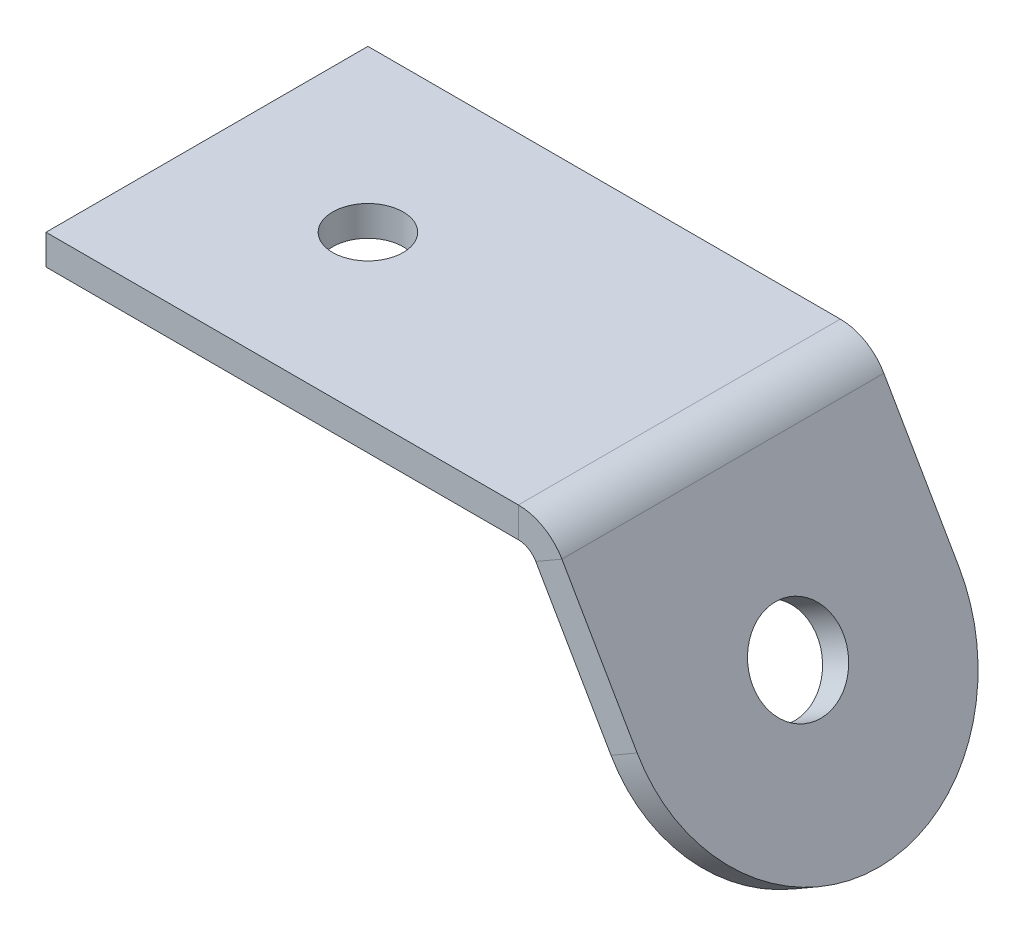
SolidWorks part; units mm, degrees
ref_plane "Front Plane" through (0, 0, 0) normal (0, 0, 1) x (1, 0, 0)
ref_plane "Top Plane" through (0, 0, 0) normal (0, 1, 0) x (1, 0, 0)
ref_plane "Right Plane" through (0, 0, 0) normal (1, 0, 0) x (0, 0, -1)
sketch "Sketch1" plane through (0, 0, 0) normal (0, 1, 0) x (1, 0, 0)
  line L0 (0, 8) -> (32, 8) construction
  line L1 (0, 0) -> (32, 0)
  line L2 (0, 0) -> (0, 16)
  line L3 (0, 16) -> (32, 16)
  arc A0 (32, 0) -> (32, 16) centre (32, 8) ccw
  circle A1 centre (32, 8) radius 2.25
  circle A2 centre (8, 8) radius 1.75
  dimension "D1" = 3.5
  dimension "D2" = 4.5
  dimension "D3" = 8
  dimension "D4" = 32
  dimension "D5" = 8
sheet metal parameters "Sheet-Metal1" thickness 1.5 parameters "D1"=1
base flange "Base-Flange1" sketch "Sketch1" thickness 1.5 reverse thickness direction yes parameters "D1"=1
sketch "Sketch3" plane through (0, 1.5, 0) normal (0, 1, 0) x (1, 0, 0)
  line L0 (24, 16) -> (24, 0)
  line L1 (32, 16) -> (0, 16) construction
  line L2 (0, 0) -> (32, 0) construction
  line L3 (0, 16) -> (0, 0) construction
  dimension "D1" = 24
sketched bend "Sketched Bend1" parameters "D1"=1
bend "SketchBend1" bend radius 1 bend angle 60 parameters "D5"=1
flat pattern "Flat-Pattern1"
sketch "Bend-Lines1" plane through (0, 0, 0) normal (0, 1, 0) x (-1, 0, 0)
bend of the flat pattern "Flatten-<SketchBend1>1"
